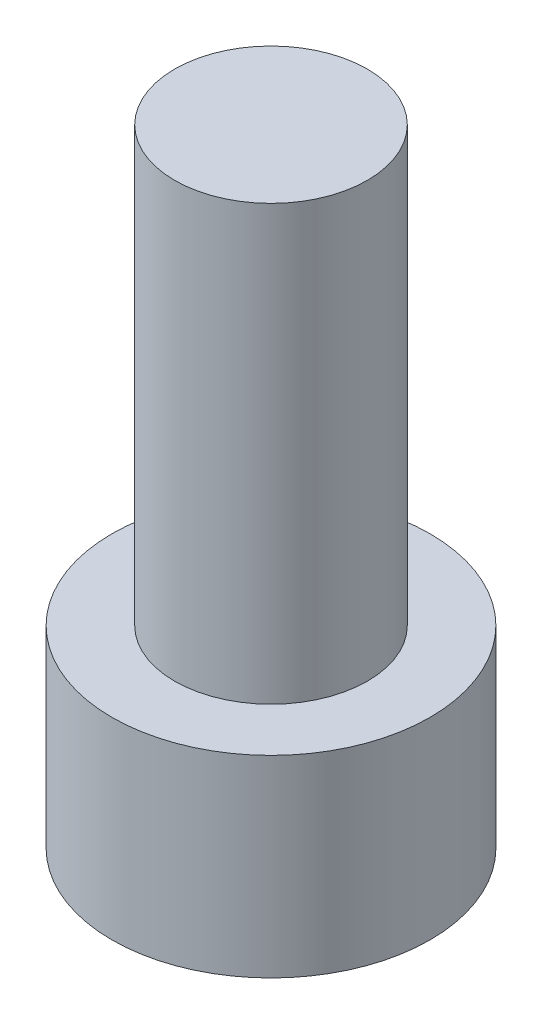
SolidWorks part; units mm, degrees
ref_plane "前视基准面" through (0, 0, 0) normal (0, 0, 1) x (1, 0, 0)
ref_plane "上视基准面" through (0, 0, 0) normal (0, 1, 0) x (1, 0, 0)
ref_plane "右视基准面" through (0, 0, 0) normal (1, 0, 0) x (0, 0, -1)
other "Configuration Table"
sketch "草图1" plane through (0, 0, 0) normal (0, 1, 0) x (1, 0, 0)
  circle A0 centre (0, 0) radius 6.6
  dimension "D1" = 13.2
extrude "凸台-拉伸1" add sketch "草图1" along normal blind 8
sketch "草图2" plane through (0, 8, 0) normal (0, 1, 0) x (1, 0, 0)
  circle A0 centre (0, 0) radius 4
  dimension "D1" = 8
extrude "凸台-拉伸2" add sketch "草图2" along normal blind 18
sketch "草图3" plane through (0, 0, 0) normal (0, -1, 0) x (1, 0, 0)
  line L1 (3.4606, 0.1554) -> (1.5958, 3.0747)
  line L2 (1.5958, 3.0747) -> (-1.8648, 2.9193)
  line L3 (-1.8648, 2.9193) -> (-3.4606, -0.1554)
  line L4 (-3.4606, -0.1554) -> (-1.5958, -3.0747)
  line L5 (-1.5958, -3.0747) -> (1.8648, -2.9193)
  line L6 (1.8648, -2.9193) -> (3.4606, 0.1554)
  circle A0 centre (0, 0) radius 3 construction
  dimension "D1" = 6
extrude "切除-拉伸1" cut sketch "草图3" against normal blind 4
